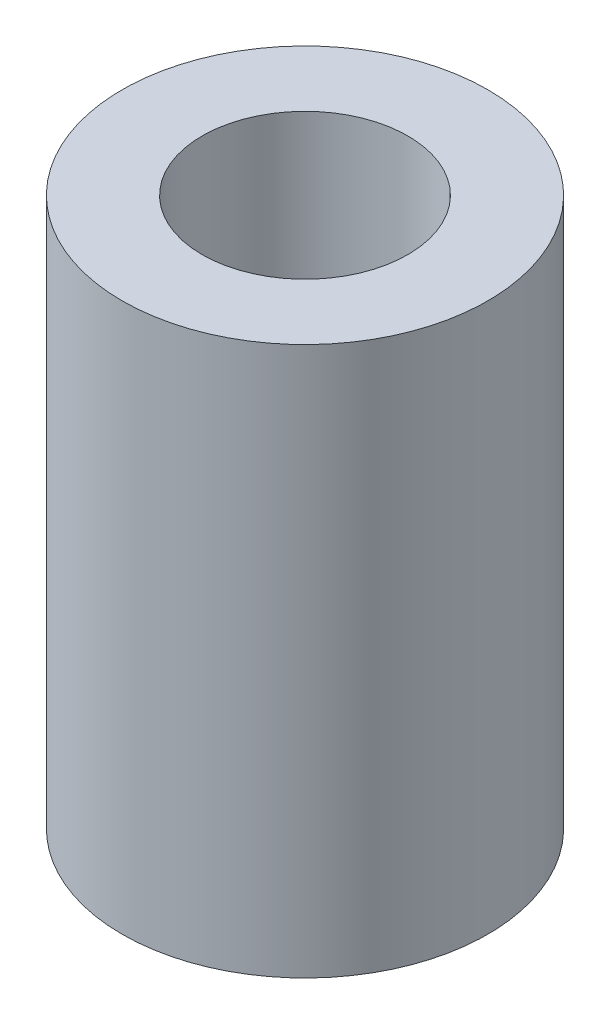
SolidWorks part; units mm, degrees
ref_plane "Front Plane" through (0, 0, 0) normal (0, 0, 1) x (1, 0, 0)
ref_plane "Top Plane" through (0, 0, 0) normal (0, 1, 0) x (1, 0, 0)
ref_plane "Right Plane" through (0, 0, 0) normal (1, 0, 0) x (0, 0, -1)
sketch "Sketch1" plane through (0, 0, 0) normal (0, 1, 0) x (1, 0, 0)
  circle A0 centre (0, 0) radius 2.25
  circle A1 centre (0, 0) radius 4
  dimension "D1" = 4.5
  dimension "D2" = 8
extrude "Extrude1" add sketch "Sketch1" along normal blind 12
